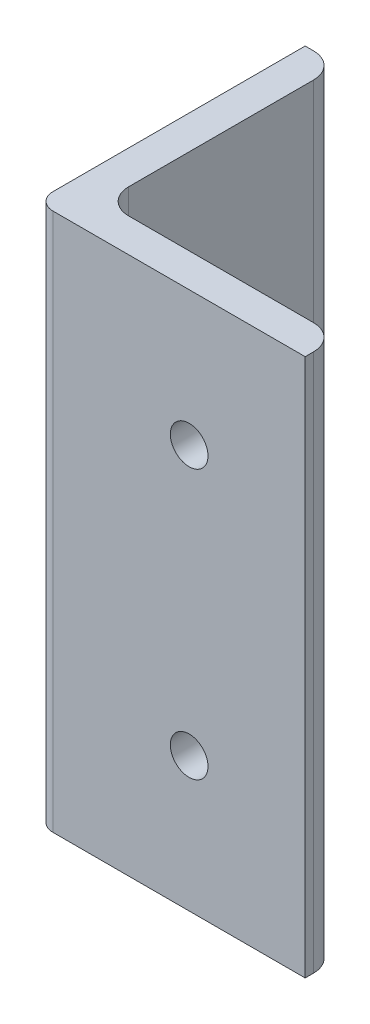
SolidWorks part; units mm, degrees
ref_plane "Front Plane" through (0, 0, 0) normal (0, 0, 1) x (1, 0, 0)
ref_plane "Top Plane" through (0, 0, 0) normal (0, 1, 0) x (1, 0, 0)
ref_plane "Right Plane" through (0, 0, 0) normal (1, 0, 0) x (0, 0, -1)
sketch "Sketch1" plane through (0, 0, 0) normal (0, 1, 0) x (1, 0, 0)
  line L0 (0, 0) -> (0, 25.4)
  line L1 (0, 25.4) -> (3.175, 25.4)
  line L2 (3.175, 25.4) -> (3.175, 3.175)
  line L3 (3.175, 3.175) -> (25.4, 3.175)
  line L4 (25.4, 3.175) -> (25.4, 0)
  line L5 (25.4, 0) -> (0, 0)
  dimension "D1" = 25.4
  dimension "D2" = 3.175
extrude "Boss-Extrude1" add sketch "Sketch1" along normal blind 50.8
fillet "Fillet1" radius 2.3813 3 edges at (3.175, 25.4, -3.175) (3.175, 25.4, -25.4) (25.4, 25.4, -3.175)
fillet "Fillet2" radius 1.5875 1 edges at (0, 25.4, 0)
sketch "Sketch3" plane through (3.175, 0, 0) normal (1, 0, 0) x (0, 0, -1)
  line L0 (13.97, 50.8) -> (13.97, 0) construction
  line L3 (25.4, 50.8) -> (1.5875, 50.8) construction
  line L7 (25.4, 0) -> (1.5875, 0) construction
  line L8 (0, 50.8) -> (0, 0) construction
  circle A4 centre (13.97, 25.4) radius 6.35
  dimension "D1" = 13.97
  dimension "D2" = 12.7
extrude "Cut-Extrude2" cut sketch "Sketch3" against normal through all
sketch "Sketch4" plane through (0, 0, -3.175) normal (0, 0, -1) x (-1, 0, 0)
  line L0 (-14.4462, 50.8) -> (-14.4462, 0) construction
  line L1 (-23.0187, 50.8) -> (-5.5563, 50.8) construction
  line L2 (-23.0187, 0) -> (-5.5563, 0) construction
  line L3 (-25.4, 25.4) -> (0, 25.4) construction
  line L4 (-25.4, 0) -> (-25.4, 50.8) construction
  line L5 (0, 50.8) -> (0, 0) construction
  line L6 (-5.5563, 0) -> (-5.5563, 50.8) construction
  circle A0 centre (-14.4462, 38.1) radius 1.778
  circle A1 centre (-14.4462, 12.7) radius 1.778
  dimension "D1" = 25.4
  dimension "D2" = 3.556
  dimension "D3" = 8.89
extrude "Cut-Extrude3" cut sketch "Sketch4" against normal through all
